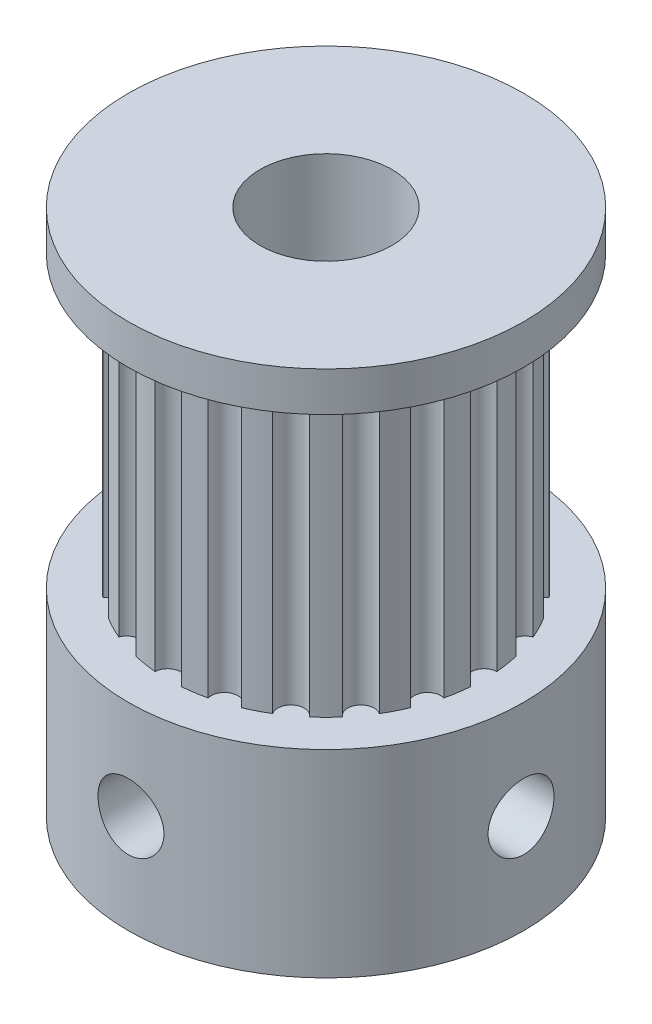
SolidWorks part; units mm, degrees
ref_plane "Ebene vorne" through (0, 0, 0) normal (0, 0, 1) x (1, 0, 0)
ref_plane "Ebene oben" through (0, 0, 0) normal (0, 1, 0) x (1, 0, 0)
ref_plane "Ebene rechts" through (0, 0, 0) normal (1, 0, 0) x (0, 0, -1)
sketch "Skizze1" plane through (0, 0, 0) normal (0, 0, 1) x (1, 0, 0)
  line L0 (2.5, -10) -> (2.5, 10)
  line L1 (2.5, 10) -> (7.5, 10)
  line L2 (7.5, 10) -> (7.5, 8.5)
  line L3 (7.5, 8.5) -> (6, 8.5)
  line L4 (6, 8.5) -> (6, -2.5)
  line L5 (6, -2.5) -> (7.5, -2.5)
  line L6 (7.5, -2.5) -> (7.5, -10)
  line L7 (7.5, -10) -> (2.5, -10)
  line L8 (0, -10) -> (0, 10) construction
  point P10 (0, 0)
  dimension "D1" = 5
  dimension "D2" = 20
  dimension "D3" = 11
  dimension "D4" = 15
  dimension "D5" = 12
  dimension "D6" = 1.5
revolve "Rotation1" add sketch "Skizze1" angle 360 about L8
sketch "Skizze2" plane through (0, -2.5, 0) normal (0, 1, 0) x (1, 0, 0)
  arc A0 (-0.4996, 5.9792) -> (0.4996, 5.9792) centre (0, 6) ccw
  circle A1 centre (0, 0) radius 6 construction
  arc A2 (0.4996, 5.9792) -> (-0.4996, 5.9792) centre (0, 0) ccw
  dimension "D1" = 0.5
extrude "Schnitt-Linear austragen1" cut sketch "Skizze2" along normal up to surface (11 mm away)
pattern_circular "Kreismuster1" count 20 over 360 about axis through (0, 0, 0) along (0, 1, 0) of "Schnitt-Linear austragen1"
hole_wizard "M3 Gewindebohrung1" positions "Skizze3" profile "Skizze4" tap size "M3" standard "DIN"
sketch "Skizze3" plane through (0, 0, 0) normal (0, 0, 1) x (1, 0, 0)
  line L0 (-7.5, -6.25) -> (0, -6.25) construction
  line L1 (-7.5, -2.5) -> (-7.5, -10) construction
  point P0 (0, -6.25)
sketch "Skizze4" plane through (0, -6.25, 0) normal (1, 0, 0) x (0, 1, 0)
  line L0 (0, 0) -> (0, 7.5)
  line L1 (0, 7.5) -> (1.25, 7.5)
  line L2 (1.25, 7.5) -> (1.25, 0)
  line L5 (1.25, 0) -> (0, 0)
  line L11 (0, -6.35) -> (0, 107.95) construction
  dimension "Bohrerdurchmesser" = 2.5
  dimension "Bohrungstiefe" = 7.5
hole_wizard "M3 Gewindebohrung2" positions "Skizze5" profile "Skizze6" tap size "M3" standard "DIN"
sketch "Skizze5" plane through (0, 0, 0) normal (1, 0, 0) x (0, 0, -1)
  line L0 (0, -6.25) -> (7.5, -6.25) construction
  line L1 (7.5, -10) -> (7.5, -2.5) construction
  point P0 (0, -6.25)
sketch "Skizze6" plane through (0, -6.25, 0) normal (0, 1, 0) x (0, 0, 1)
  line L0 (0, 0) -> (0, 7.5)
  line L1 (0, 7.5) -> (1.25, 7.5)
  line L2 (1.25, 7.5) -> (1.25, 0)
  line L5 (1.25, 0) -> (0, 0)
  line L11 (0, -6.35) -> (0, 107.95) construction
  dimension "Bohrerdurchmesser" = 2.5
  dimension "Bohrungstiefe" = 7.5
